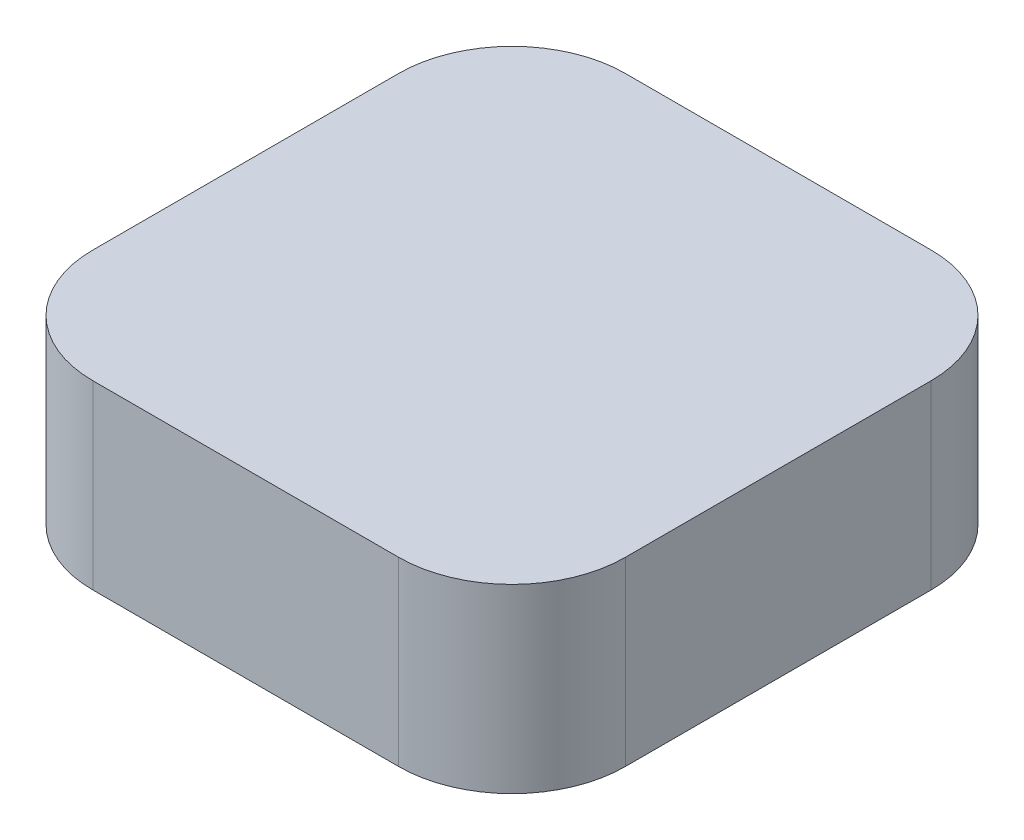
SolidWorks part; units mm, degrees
ref_plane "前视基准面" through (0, 0, 0) normal (0, 0, 1) x (1, 0, 0)
ref_plane "上视基准面" through (0, 0, 0) normal (0, 1, 0) x (1, 0, 0)
ref_plane "右视基准面" through (0, 0, 0) normal (1, 0, 0) x (0, 0, -1)
other "Configuration Table"
sketch "草图1" plane through (0, 0, 0) normal (0, 1, 0) x (1, 0, 0)
  line L1 (-2.35, -2.35) -> (2.35, -2.35)
  line L2 (-2.35, -2.35) -> (-2.35, 2.35)
  line L3 (-2.35, 2.35) -> (2.35, 2.35)
  line L4 (2.35, -2.35) -> (2.35, 2.35)
  line L5 (-2.35, -2.35) -> (2.35, 2.35) construction
  line L6 (-2.35, 2.35) -> (2.35, -2.35) construction
  point P0 (0, 0)
  dimension "D1" = 4.7
  dimension "D2" = 4.7
extrude "凸台-拉伸1" add sketch "草图1" along normal blind 1.6
fillet "圆角1" radius 1 4 edges at (-2.35, 0.8, -2.35) (-2.35, 0.8, 2.35) (2.35, 0.8, -2.35) (2.35, 0.8, 2.35)
